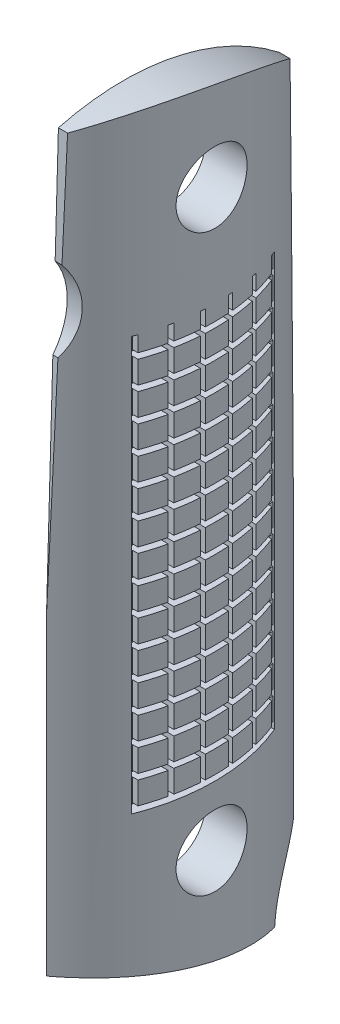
SolidWorks part; units mm, degrees
ref_plane "Front Plane" through (0, 0, 0) normal (0, 0, 1) x (1, 0, 0)
ref_plane "Top Plane" through (0, 0, 0) normal (0, 1, 0) x (1, 0, 0)
ref_plane "Right Plane" through (0, 0, 0) normal (1, 0, 0) x (0, 0, -1)
mirrored part "rightHandle_Mirrored"
other "<rightHandle>-<LPattern2>"
